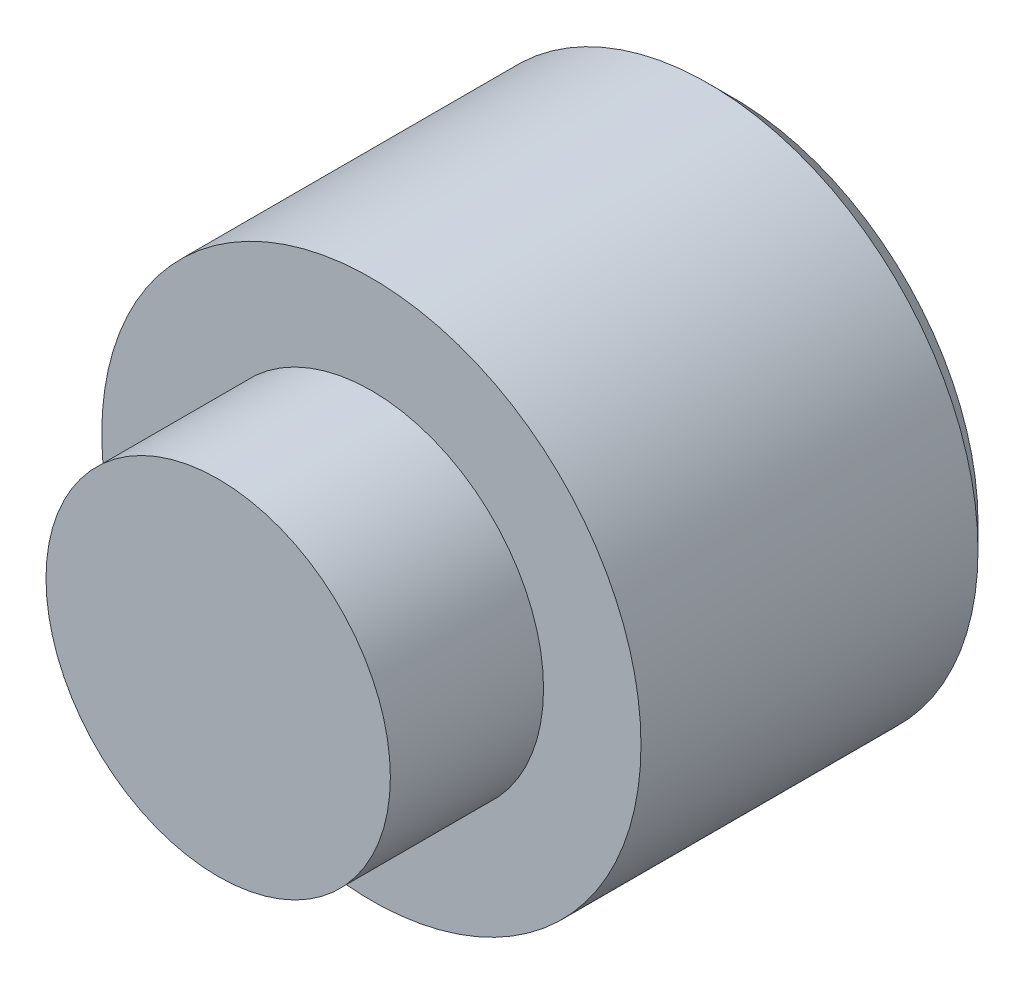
SolidWorks part; units mm, degrees
ref_plane "Front Plane" through (0, 0, 0) normal (0, 0, 1) x (1, 0, 0)
ref_plane "Top Plane" through (0, 0, 0) normal (0, 1, 0) x (1, 0, 0)
ref_plane "Right Plane" through (0, 0, 0) normal (1, 0, 0) x (0, 0, -1)
sketch "Sketch1" plane through (0, 0, 0) normal (0, 0, 1) x (1, 0, 0)
  circle A0 centre (0, 0) radius 3.5687
  dimension "D1" = 7.1374
extrude "Boss-Extrude1" add sketch "Sketch1" along normal blind 3.175
sketch "Sketch2" plane through (0, 0, 0) normal (0, 0, -1) x (-1, 0, 0)
  circle A0 centre (0, 0) radius 5.588
  dimension "D1" = 11.176
extrude "Boss-Extrude2" add sketch "Sketch2" along normal blind 7.493
chamfer "Chamfer1" distance 0.508 angle 45 1 edges at (-5.588, 0, -7.493)
